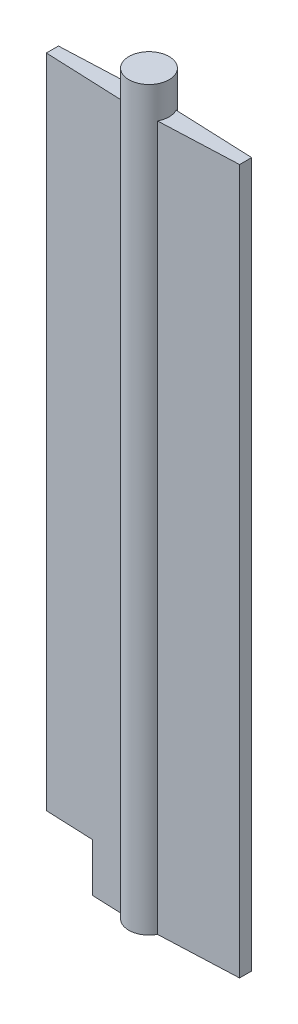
SolidWorks part; units mm, degrees
ref_plane "Front Plane" through (0, 0, 0) normal (0, 0, 1) x (1, 0, 0)
ref_plane "Top Plane" through (0, 0, 0) normal (0, 1, 0) x (1, 0, 0)
ref_plane "Right Plane" through (0, 0, 0) normal (1, 0, 0) x (0, 0, -1)
sketch "Sketch1" plane through (0, 0, 0) normal (0, 1, 0) x (1, 0, 0)
  line L0 (0, 3.175) -> (0, -3.175)
  line L3 (0, 3.175) -> (30.48, 1.905)
  line L4 (30.48, 1.905) -> (30.48, -1.905)
  line L5 (30.48, -1.905) -> (0, -3.175)
  line L6 (-30.48, -1.905) -> (0, -3.175)
  line L7 (-30.48, 1.905) -> (-30.48, -1.905)
  line L8 (0, 3.175) -> (-30.48, 1.905)
  circle A0 centre (0, 0) radius 6.35
  point P5 (30.48, 0)
  point P6 (0, 0)
  dimension "D1" = 12.7
  dimension "D2" = 6.35
  dimension "D3" = 3.81
  dimension "D4" = 30.48
extrude "Boss-Extrude1" add sketch "Sketch1" along normal blind 222.25 contours A0 L5 L4 L3 | A0 L8 L7 L6
sketch "Sketch2" plane through (0, 222.25, 0) normal (0, 1, 0) x (1, 0, 0)
  circle A0 centre (0, 0) radius 6.35
extrude "Boss-Extrude2" add sketch "Sketch2" along normal blind 10.16
sketch "Sketch3" plane through (0, 0, 0) normal (0, 0, 1) x (1, 0, 0)
  line L1 (-30.48, 0) -> (-15.24, 0)
  line L2 (-30.48, 0) -> (-30.48, 15.24)
  line L3 (-30.48, 15.24) -> (-15.24, 15.24)
  line L4 (-15.24, 0) -> (-15.24, 15.24)
  dimension "D1" = 15.24
  dimension "D2" = 15.24
extrude "Cut-Extrude1" cut sketch "Sketch3" against normal through all both and the other way through all
ref_plane "Plane1" through (0, 226.06, 0) normal (0, 1, 0) x (1, 0, 0)
sketch "Sketch4" plane through (0, 226.06, 0) normal (0, 1, 0) x (1, 0, 0)
  line L0 (5.3882, 5.3882) -> (-20.0118, 30.7882)
  line L2 (-30.7882, 20.0118) -> (-5.3882, -5.3882)
  arc A1 (-5.3882, -5.3882) -> (5.3882, 5.3882) centre (0, 0) ccw
  arc A2 (-20.0118, 30.7882) -> (-30.7882, 20.0118) centre (-25.4, 25.4) ccw
  circle A4 centre (0, 0) radius 6.35 construction
  circle A5 centre (0, 0) radius 6.35
  circle A6 centre (-25.4, 25.4) radius 1.5875
  dimension "D2" = 7.62
  dimension "D6" = 3.175
  dimension "D3" = 15.24
  dimension "D4" = 25.4
  dimension "D5" = 25.4
extrude "Boss-Extrude3" [suppressed] add sketch "Sketch4" along normal blind 3.175
